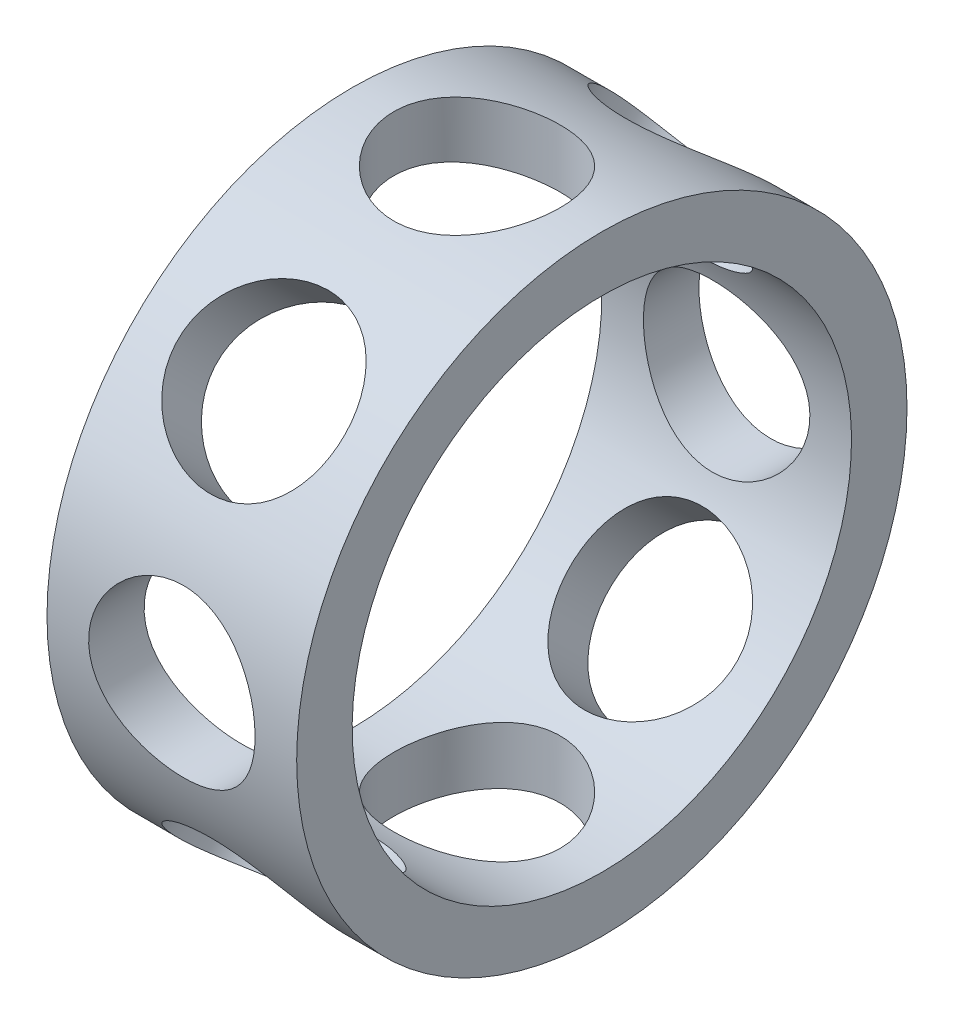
SolidWorks part; units mm, degrees
ref_plane "Front Plane" through (0, 0, 0) normal (0, 0, 1) x (1, 0, 0)
ref_plane "Top Plane" through (0, 0, 0) normal (0, 1, 0) x (1, 0, 0)
ref_plane "Right Plane" through (0, 0, 0) normal (1, 0, 0) x (0, 0, -1)
sketch "Sketch1" plane through (0, 0, 0) normal (0, 0, 1) x (1, 0, 0)
  line L0 (-2.25, 5.5) -> (2.25, 5.5)
  line L1 (2.25, 5.5) -> (2.25, 4.5)
  line L2 (2.25, 4.5) -> (-2.25, 4.5)
  line L3 (-2.25, 4.5) -> (-2.25, 5.5)
  line L4 (-2.25, 0) -> (2.25, 0) construction
  line L5 (-2.25, 5) -> (2.25, 5) construction
  point P9 (0, 5)
  dimension "D1" = 4.5
  dimension "D2" = 5
  dimension "D3" = 1
revolve "Revolve1" add sketch "Sketch1" angle 360 about L4
sketch "Sketch2" plane through (0, 0, 0) normal (0, 1, 0) x (1, 0, 0)
  circle A0 centre (0, 0) radius 1.5
  dimension "D1" = 3
extrude "Cut-Extrude2" cut sketch "Sketch2" against normal up to next
pattern_circular "CirPattern1" count 8 over 360 about axis through (-2.25, 0, 0) along (-1, 0, 0) of "Cut-Extrude2"
